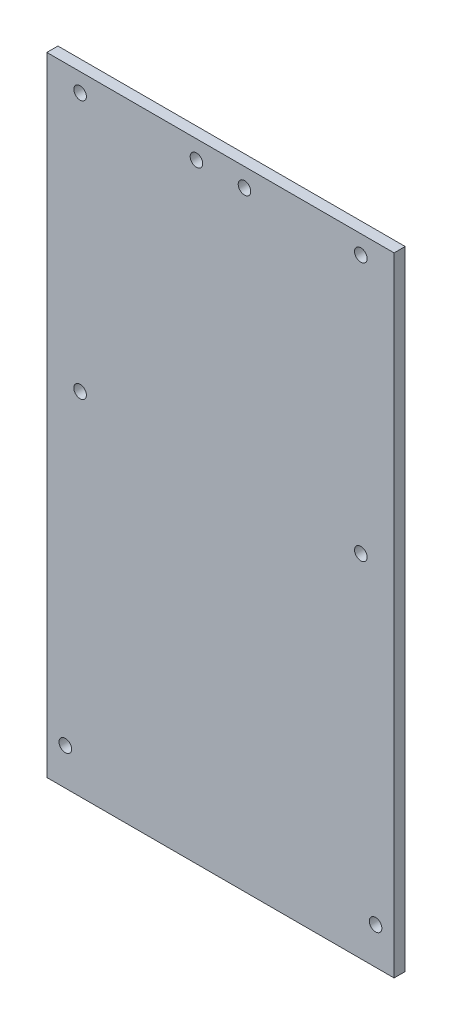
SolidWorks part; units mm, degrees
ref_plane "前视基准面" through (0, 0, 0) normal (0, 0, 1) x (1, 0, 0)
ref_plane "上视基准面" through (0, 0, 0) normal (0, 1, 0) x (1, 0, 0)
ref_plane "右视基准面" through (0, 0, 0) normal (1, 0, 0) x (0, 0, -1)
sketch "草图1" plane through (0, 0, 0) normal (0, 0, 1) x (1, 0, 0)
  line L1 (-47, 85) -> (47, 85)
  line L2 (-47, 85) -> (-47, -85)
  line L3 (-47, -85) -> (47, -85)
  line L4 (47, 85) -> (47, -85)
  line L5 (-47, 85) -> (47, -85) construction
  line L6 (-47, -85) -> (47, 85) construction
  point P0 (0, 0)
  dimension "D1" = 94
  dimension "D2" = 170
extrude "凸台-拉伸1" add sketch "草图1" along normal blind 3
hole_wizard "Ø3.4 (3.4) 直径孔1" positions "草图2" profile "草图3" hole size "Ø3.4" standard "GB"
sketch "草图2" plane through (0, 0, 0) normal (0, 0, -1) x (-1, 0, 0)
  point P0 (-6.5, 80)
  point P3 (6.5, 80)
sketch "草图3" plane through (6.5, 80, 0) normal (1, 0, 0) x (0, 1, 0)
  line L0 (0, 0) -> (0, 3)
  line L1 (0, 3) -> (1.7, 3)
  line L2 (1.7, 3) -> (1.7, 0)
  line L5 (1.7, 0) -> (0, 0)
  line L11 (0, -6.35) -> (0, 107.95) construction
  dimension "通孔孔直径" = 3.4
  dimension "通孔孔深度" = 3
hole_wizard "Ø3.4 (3.4) 直径孔2" positions "草图4" profile "草图5" hole size "Ø3.4" standard "GB"
sketch "草图4" plane through (0, 0, 0) normal (0, 0, -1) x (-1, 0, 0)
  point P0 (-42, -75)
  point P3 (42, -75)
sketch "草图5" plane through (42, -75, 0) normal (1, 0, 0) x (0, 1, 0)
  line L0 (0, 0) -> (0, 3)
  line L1 (0, 3) -> (1.7, 3)
  line L2 (1.7, 3) -> (1.7, 0)
  line L5 (1.7, 0) -> (0, 0)
  line L11 (0, -6.35) -> (0, 107.95) construction
  dimension "通孔孔直径" = 3.4
  dimension "通孔孔深度" = 3
hole_wizard "Ø3.4 (3.4) 直径孔3" positions "草图6" profile "草图7" hole size "Ø3.4" standard "GB"
sketch "草图6" plane through (0, 0, 0) normal (0, 0, -1) x (-1, 0, 0)
  point P0 (-38, 80)
  point P3 (38, 80)
  point P6 (38, 10)
  point P9 (-38, 10)
sketch "草图7" plane through (38, 80, 0) normal (1, 0, 0) x (0, 1, 0)
  line L0 (0, 0) -> (0, 3)
  line L1 (0, 3) -> (1.7, 3)
  line L2 (1.7, 3) -> (1.7, 0)
  line L5 (1.7, 0) -> (0, 0)
  line L11 (0, -6.35) -> (0, 107.95) construction
  dimension "通孔孔直径" = 3.4
  dimension "通孔孔深度" = 3
